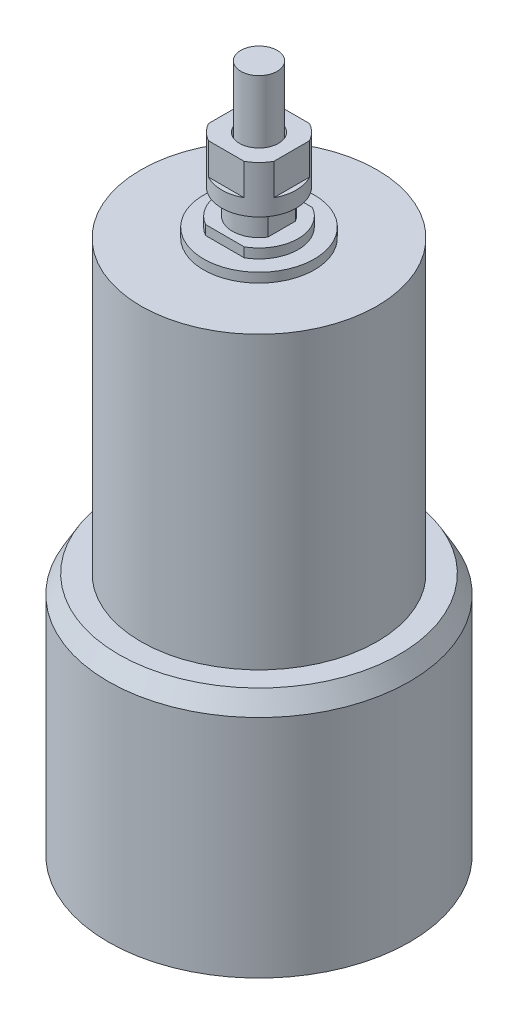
SolidWorks part; units mm, degrees
ref_plane "Front" through (0, 0, 0) normal (0, 0, 1) x (1, 0, 0)
ref_plane "Top" through (0, 0, 0) normal (0, 1, 0) x (1, 0, 0)
ref_plane "Right" through (0, 0, 0) normal (1, 0, 0) x (0, 0, -1)
sketch "Sketch1" plane through (0, 0, 0) normal (0, 1, 0) x (1, 0, 0)
  circle A0 centre (0, 0) radius 41.275
  dimension "D1" = 82.55
extrude "Extrude1" add sketch "Sketch1" along normal blind 101.6
sketch "Sketch2" plane through (0, 101.6, 0) normal (0, 1, 0) x (-1, 0, 0)
  circle A0 centre (0, 0) radius 19.3675
  dimension "D1" = 38.735
extrude "Extrude2" add sketch "Sketch2" along normal blind 3.302
sketch "Sketch3" plane through (0, 104.902, 0) normal (0, 1, 0) x (-1, 0, 0)
  line L0 (-6.747, -11.9126) -> (6.747, -11.9126)
  line L1 (0, 0) -> (9.6888, 0) construction
  line L2 (-6.747, 11.9126) -> (6.747, 11.9126)
  arc A0 (-6.747, 11.9126) -> (-6.747, -11.9126) centre (0, 0) ccw
  arc A1 (6.747, -11.9126) -> (6.747, 11.9126) centre (0, 0) ccw
  dimension "D1" = 27.3812
  dimension "D2" = 23.8252
extrude "Extrude3" add sketch "Sketch3" along normal blind 3.3274
sketch "Sketch4" plane through (0, 108.2294, 0) normal (0, 1, 0) x (-1, 0, 0)
  line L0 (-7.9375, -4.7904) -> (-7.9375, 4.7904)
  line L1 (0, 0) -> (0, 49.8949) construction
  line L2 (7.9375, -4.7904) -> (7.9375, 4.7904)
  arc A0 (-7.9375, -4.7904) -> (7.9375, -4.7904) centre (0, 0) ccw
  arc A1 (7.9375, 4.7904) -> (-7.9375, 4.7904) centre (0, 0) ccw
  dimension "D1" = 18.542
  dimension "D2" = 15.875
extrude "Extrude4" add sketch "Sketch4" along normal blind 8.89
sketch "Sketch5" plane through (0, 117.1194, 0) normal (0, 1, 0) x (-1, 0, 0)
  circle A0 centre (0, 0) radius 13.0175
  circle A1 centre (0, 0) radius 6.8199
  dimension "D1" = 26.035
  dimension "D2" = 13.6398
extrude "Extrude5" add sketch "Sketch5" along normal blind 16.51
sketch "Sketch6" plane through (0, 133.6294, 0) normal (0, 1, 0) x (-1, 0, 0)
  line L0 (0, 0) -> (0, 27.4282) construction
  line L1 (0, 0) -> (-25.5091, 0) construction
  line L3 (-11.43, -11.43) -> (11.43, -11.43)
  line L4 (-11.43, -11.43) -> (-11.43, 11.43)
  line L5 (-11.43, 11.43) -> (11.43, 11.43)
  line L6 (11.43, -11.43) -> (11.43, 11.43)
  circle A0 centre (0, 0) radius 25.4
  dimension "D3" = 50.8
  dimension "D1" = 22.86
  dimension "D2" = 22.86
extrude "Cut-Extrude1" cut sketch "Sketch6" against normal blind 11.0236
sketch "Sketch7" plane through (0, 0, 0) normal (0, -1, 0) x (1, 0, 0)
  circle A0 centre (0, 0) radius 52.705
  dimension "D1" = 105.41
extrude "Extrude6" add sketch "Sketch7" along normal blind 88.9
sketch "Sketch8" plane through (0, 117.1194, 0) normal (0, 1, 0) x (-1, 0, 0)
  circle A0 centre (0, 0) radius 6.35
  dimension "D1" = 12.7
extrude "Extrude7" add sketch "Sketch8" along normal blind 38.1
chamfer "Chamfer1" distance 6.35 angle 30 2 edges at (0, 0, -52.705) (0, -88.9, -52.705)
